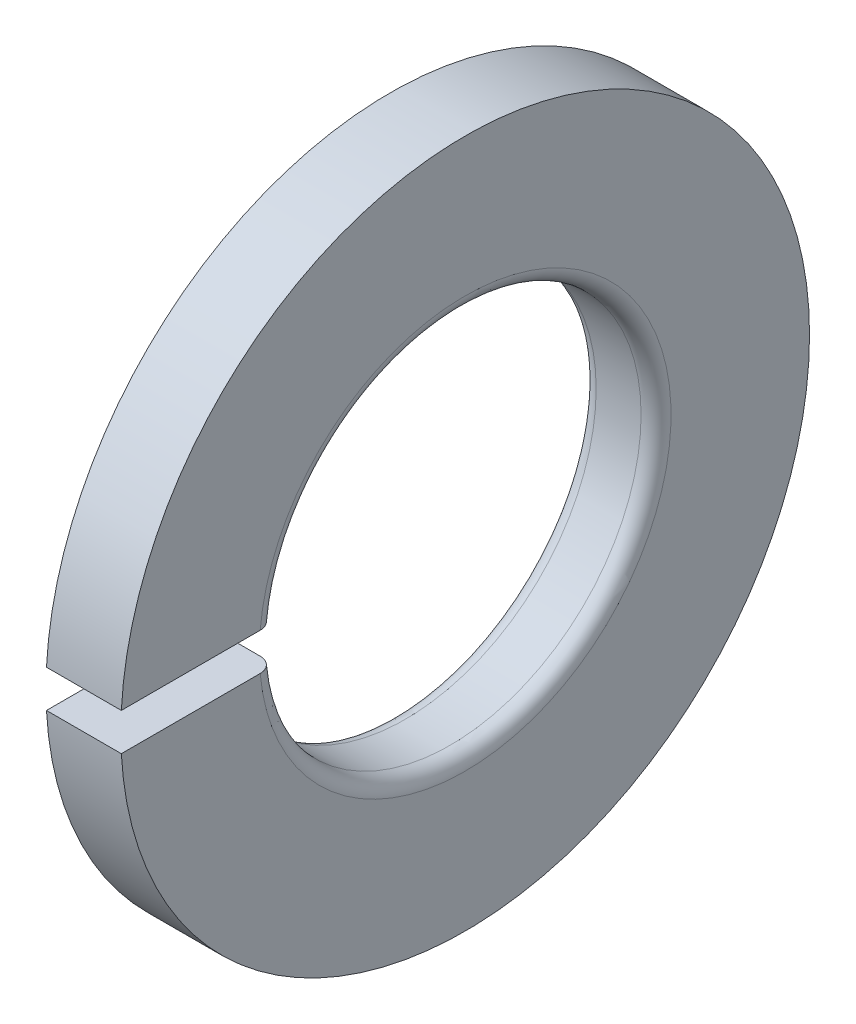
SolidWorks part; units mm, degrees
ref_plane "Plane1" through (0, 0, 0) normal (0, 0, 1) x (1, 0, 0)
ref_plane "Plane2" through (0, 0, 0) normal (0, 1, 0) x (1, 0, 0)
ref_plane "Plane3" through (0, 0, 0) normal (1, 0, 0) x (0, 0, -1)
revolve "Base-Revolve" add sketch "Sketch1" angle 360 about L0
sketch "Sketch1" plane through (0, 0, 0) normal (0, 0, 1) x (1, 0, 0)
  line L0 (-34.925, 0) -> (9.525, 0) construction
  line L1 (0, 2.75) -> (0, 4.6)
  line L2 (0, 4.6) -> (-1, 4.6)
  line L3 (-1, 4.6) -> (-1, 2.75)
  line L4 (-0.8, 2.55) -> (-0.2, 2.55)
  arc A0 (-0.8, 2.55) -> (-1, 2.75) centre (-0.8, 2.75) cw
  arc A1 (0, 2.75) -> (-0.2, 2.55) centre (-0.2, 2.75) cw
  point P8 (-1, 2.55)
  dimension "Fillet_rad" = 0.2
  dimension "D1" = 0.2
  dimension "Thickness" = 1
  dimension "Inside_dia" = 5.1
  dimension "Outside_dia" = 9.2
extrude "Gap" cut sketch "Sketch2" along normal through all
sketch "Sketch2" plane through (0, 0, 0) normal (-1, 0, 0) x (0, -1, 0)
  line L0 (-0.25, 0) -> (0.25, 0)
  line L1 (0, 0) -> (0, 12.7) construction
  line L2 (0.25, 0) -> (0.25, 4.692)
  line L3 (0.25, 4.692) -> (-0.25, 4.692)
  line L4 (-0.25, 4.692) -> (-0.25, 0)
  dimension "D1" = 0.5
  dimension "D2" = 4.692
equation "\"D1@Sketch1\" = \"Fillet_rad@Sketch1\""
equation "\"D1@Sketch2\" = \"Thickness@Sketch1\" * 0.5"
equation "\"D2@Sketch2\" = \"Outside_dia@Sketch1\" * 0.51"
